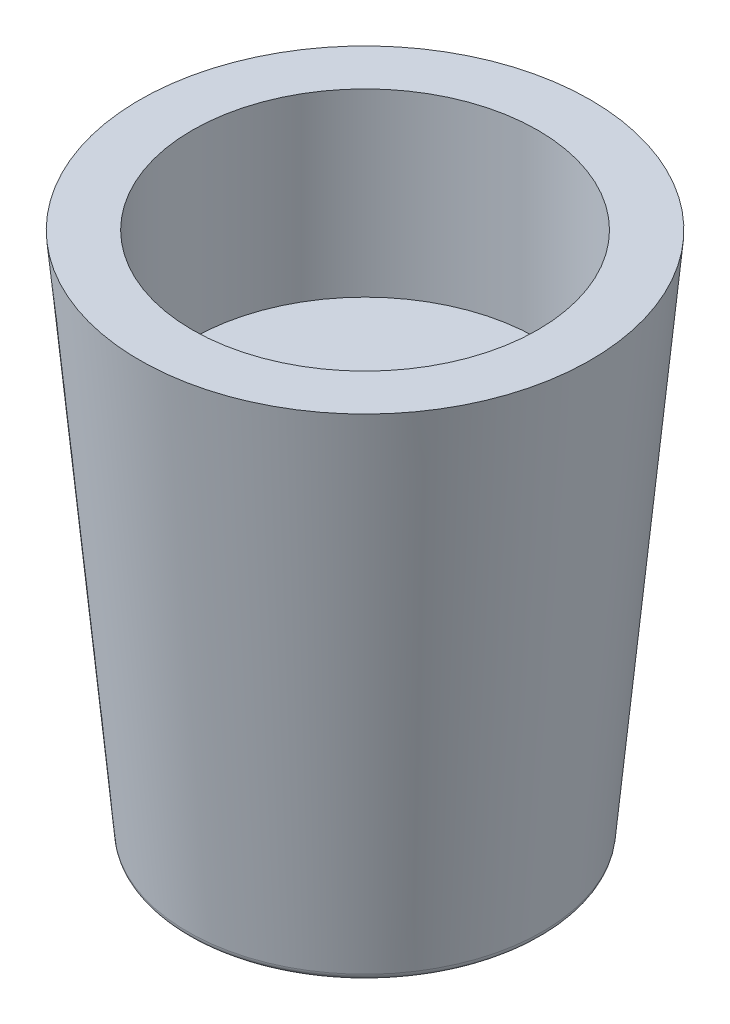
SolidWorks part; units mm, degrees
ref_plane "Front Plane" through (0, 0, 0) normal (0, 0, 1) x (1, 0, 0)
ref_plane "Top Plane" through (0, 0, 0) normal (0, 1, 0) x (1, 0, 0)
ref_plane "Right Plane" through (0, 0, 0) normal (1, 0, 0) x (0, 0, -1)
sketch "Sketch1" plane through (0, 0, 0) normal (0, 0, 1) x (1, 0, 0)
  line L0 (0, 0) -> (0, 46)
  line L2 (30, 70) -> (23.5, 0)
  line L3 (23.5, 0) -> (0, 0)
  line L4 (30, 70) -> (23, 70)
  line L5 (23, 70) -> (23, 46)
  line L6 (23, 46) -> (0, 46)
  dimension "D1" = 70
  dimension "D2" = 30
  dimension "D3" = 23.5
  dimension "D4" = 7
  dimension "D5" = 24
revolve "Revolve1" add sketch "Sketch1" angle 360 about L0
fillet "Fillet1" radius 1 1 edges at (0, 0, -23.5)
